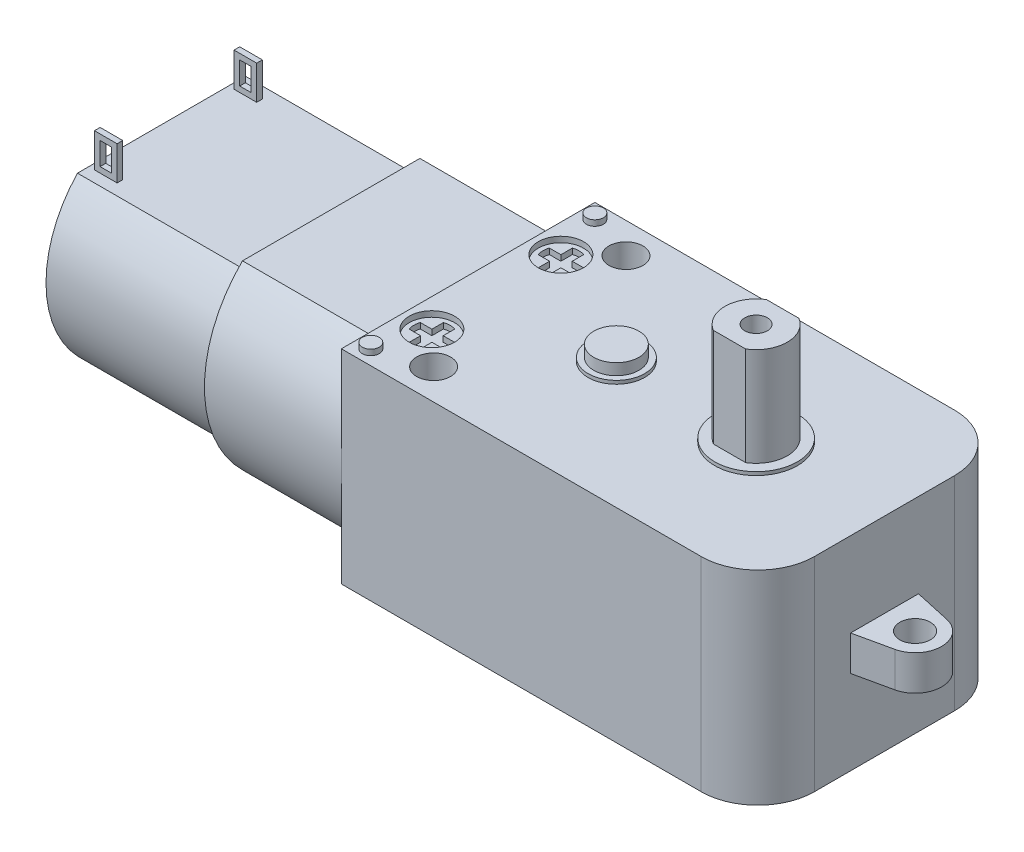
SolidWorks part; units mm, degrees
ref_plane "Front Plane" through (0, 0, 0) normal (0, 0, 1) x (1, 0, 0)
ref_plane "Top Plane" through (0, 0, 0) normal (0, 1, 0) x (1, 0, 0)
ref_plane "Right Plane" through (0, 0, 0) normal (1, 0, 0) x (0, 0, -1)
sketch "Sketch1" plane through (0, 0, 0) normal (0, 1, 0) x (1, 0, 0)
  line L1 (0, 0) -> (36.8, 0)
  line L2 (0, 0) -> (0, 22.4)
  line L3 (0, 22.4) -> (36.8, 22.4)
  line L4 (36.8, 0) -> (36.8, 22.4)
  dimension "D1" = 36.8
  dimension "D2" = 22.4
extrude "Extrude1" add sketch "Sketch1" along normal mid plane 18
fillet "Fillet1" radius 5 2 edges at (36.8, 0, -22.4) (36.8, 0, 0)
sketch "Sketch2" plane through (0, 0, 0) normal (0, 1, 0) x (1, 0, 0)
  line L0 (36.8, 11.2) -> (43.7927, 11.2) construction
  line L1 (36.8, 5) -> (36.8, 17.4) construction
  line L2 (36.8, 14.2) -> (40.0048, 13.4951)
  line L3 (36.8, 8.2) -> (40.0048, 8.9049)
  line L4 (36.8, 14.2) -> (36.8, 8.2)
  circle A0 centre (39.5, 11.2) radius 1.35
  arc A1 (40.0048, 8.9049) -> (40.0048, 13.4951) centre (39.5, 11.2) ccw
  dimension "D1" = 2.7
  dimension "D3" = 1
  dimension "D2" = 3
  dimension "D4" = 2.7
extrude "Extrude2" add sketch "Sketch2" along normal mid plane 3.1
sketch "Sketch3" plane through (0, 9, 0) normal (0, 1, 0) x (1, 0, 0)
  line L0 (36.8, 11.2) -> (0, 11.2) construction
  line L1 (36.8, 5) -> (36.8, 17.4) construction
  line L2 (0, 22.4) -> (0, 0) construction
  circle A0 centre (25.45, 11.2) radius 3.65
  circle A1 centre (13.1, 11.2) radius 2.5
  dimension "D1" = 7.3
  dimension "D2" = 11.35
  dimension "D3" = 5
  dimension "D4" = 12.35
extrude "Extrude3" add sketch "Sketch3" along normal blind 0.3
sketch "Sketch4" plane through (0, 9.3, 0) normal (0, 1, 0) x (1, 0, 0)
  line L0 (22.7, 11.2) -> (28.2, 11.2) construction
  line L1 (24.0217, 8.85) -> (26.8783, 8.85)
  line L2 (24.0217, 13.55) -> (26.8783, 13.55)
  line L3 (22.7, 13.55) -> (28.2, 13.55) construction
  line L4 (22.7, 8.85) -> (28.2, 8.85) construction
  arc A0 (24.0217, 13.55) -> (24.0217, 8.85) centre (25.45, 11.2) ccw
  circle A1 centre (25.45, 11.2) radius 1
  arc A2 (26.8783, 8.85) -> (26.8783, 13.55) centre (25.45, 11.2) ccw
  dimension "D1" = 5.5
  dimension "D2" = 2
  dimension "D3" = 2.35
  dimension "D4" = 2.35
extrude "Extrude4" add sketch "Sketch4" along normal blind 8.7
sketch "Sketch6" plane through (0, 9.3, 0) normal (0, 1, 0) x (1, 0, 0)
  circle A0 centre (13.1, 11.2) radius 2
  dimension "D1" = 4
extrude "Extrude5" add sketch "Sketch6" along normal blind 1
sketch "Sketch7" plane through (0, 9, 0) normal (0, 1, 0) x (1, 0, 0)
  line L0 (5.45, 22.4) -> (5.45, 0) construction
  line L1 (31.8, 22.4) -> (0, 22.4) construction
  line L2 (0, 0) -> (31.8, 0) construction
  line L4 (0, 11.2) -> (8.5993, 11.2) construction
  line L5 (0, 22.4) -> (0, 0) construction
  circle A0 centre (5.45, 19.7) radius 1.5
  circle A1 centre (5.45, 2.7) radius 1.5
  circle A2 centre (25.45, 11.2) radius 3.65 construction
  dimension "D1" = 3
  dimension "D2" = 8.5
  dimension "D3" = 8.5
  dimension "D4" = 20
extrude "Extrude6" cut sketch "Sketch7" against normal through all
sketch "Sketch8" plane through (0, 9, 0) normal (0, 1, 0) x (1, 0, 0)
  line L0 (2.5, 22.4) -> (2.5, 0) construction
  line L1 (31.8, 22.4) -> (0, 22.4) construction
  line L2 (0, 0) -> (31.8, 0) construction
  line L3 (0, 22.4) -> (0, 0) construction
  circle A0 centre (2.5, 16.9) radius 2
  circle A1 centre (2.5, 5.5) radius 2
  dimension "D1" = 4
  dimension "D2" = 5.5
  dimension "D3" = 5.5
  dimension "D4" = 2.5
extrude "Extrude7" cut sketch "Sketch8" against normal blind 0.5
sketch "Sketch9" plane through (0, 8.5, 0) normal (0, 1, 0) x (1, 0, 0)
  line L0 (2.5, 18.5) -> (2.5, 15.3) construction
  line L1 (4.1, 16.9) -> (0.9, 16.9) construction
  line L2 (0.9, 5.5) -> (4.1, 5.5) construction
  line L3 (2.5, 7.1) -> (2.5, 3.9) construction
  line L4 (2, 7.0199) -> (2, 6)
  line L5 (3, 7.0199) -> (3, 6)
  line L6 (4.0199, 17.4) -> (3, 17.4)
  line L7 (2, 18.4199) -> (2, 17.4)
  line L8 (0.9801, 5) -> (2, 5)
  line L9 (4.0199, 16.4) -> (3, 16.4)
  line L10 (3, 18.4199) -> (3, 17.4)
  line L11 (0.9801, 6) -> (2, 6)
  line L12 (2, 18.5) -> (2, 15.3) construction
  line L13 (3, 18.5) -> (3, 15.3) construction
  line L14 (4.1, 17.4) -> (0.9, 17.4) construction
  line L15 (4.1, 16.4) -> (0.9, 16.4) construction
  line L16 (2, 7.1) -> (2, 3.9) construction
  line L17 (3, 7.1) -> (3, 3.9) construction
  line L18 (0.9, 6) -> (4.1, 6) construction
  line L19 (0.9, 5) -> (4.1, 5) construction
  line L20 (2, 17.4) -> (0.9801, 17.4)
  line L21 (2, 16.4) -> (2, 15.3801)
  line L22 (3, 16.4) -> (3, 15.3801)
  line L23 (2, 16.4) -> (0.9801, 16.4)
  line L24 (3, 6) -> (4.0199, 6)
  line L25 (2, 5) -> (2, 3.9801)
  line L26 (3, 5) -> (3, 3.9801)
  line L27 (3, 5) -> (4.0199, 5)
  arc A0 (3, 7.0199) -> (2, 7.0199) centre (2.5, 5.5) ccw
  arc A1 (3, 18.4199) -> (2, 18.4199) centre (2.5, 16.9) ccw
  arc A2 (4.0199, 16.4) -> (4.0199, 17.4) centre (2.5, 16.9) ccw
  arc A3 (2, 15.3801) -> (3, 15.3801) centre (2.5, 16.9) ccw
  arc A4 (0.9801, 17.4) -> (0.9801, 16.4) centre (2.5, 16.9) ccw
  arc A5 (4.0199, 5) -> (4.0199, 6) centre (2.5, 5.5) ccw
  arc A6 (2, 3.9801) -> (3, 3.9801) centre (2.5, 5.5) ccw
  arc A7 (0.9801, 6) -> (0.9801, 5) centre (2.5, 5.5) ccw
  dimension "D1" = 3.2
  dimension "D6" = 1.6
  dimension "D2" = 0.5
  dimension "D3" = 0.5
  dimension "D4" = 0.5
  dimension "D5" = 0.5
extrude "Extrude8" cut sketch "Sketch9" against normal blind 0.5
sketch "Sketch10" plane through (0, 9, 0) normal (0, 1, 0) x (1, 0, 0)
  line L0 (1.3, 22.4) -> (1.3, 0) construction
  line L1 (31.8, 22.4) -> (0, 22.4) construction
  line L2 (0, 0) -> (31.8, 0) construction
  line L3 (0, 22.4) -> (0, 0) construction
  circle A0 centre (1.3, 21.1) radius 0.75
  circle A1 centre (1.3, 1.3) radius 0.75
  dimension "D1" = 1.5
  dimension "D3" = 1.3
  dimension "D4" = 1.3
  dimension "D2" = 1.3
extrude "Extrude9" add sketch "Sketch10" along normal blind 0.5
sketch "Sketch12" plane through (0, 0, 0) normal (-1, 0, 0) x (0, 0, 1)
  line L0 (-22.4, 9) -> (0, -9) construction
  line L1 (-19.0384, 8) -> (-3.3616, 8)
  line L4 (-3.3616, -8) -> (-19.0384, -8)
  line L5 (-11.2, 0) -> (-22.4, 0) construction
  arc A0 (-19.0384, 8) -> (-19.0384, -8) centre (-11.2, 0) ccw
  arc A1 (-3.3616, -8) -> (-3.3616, 8) centre (-11.2, 0) ccw
  dimension "D1" = 16
  dimension "D2" = 8
extrude "Extrude11" add sketch "Sketch12" along normal blind 12.1
sketch "Sketch13" plane through (-12.1, 0, 0) normal (-1, 0, 0) x (0, 0, 1)
  line L14 (-18.6189, -7) -> (-3.7811, -7)
  line L15 (-3.7811, 7) -> (-18.6189, 7)
  line L16 (-18.6189, -7) -> (-3.7811, -7)
  line L17 (-3.7811, 7) -> (-18.6189, 7)
  arc A14 (-18.6189, 7) -> (-18.6189, -7) centre (-11.2, 0) ccw
  arc A15 (-3.7811, -7) -> (-3.7811, 7) centre (-11.2, 0) ccw
  arc A16 (-18.6189, 7) -> (-18.6189, -7) centre (-11.2, 0) ccw
  arc A17 (-3.7811, -7) -> (-3.7811, 7) centre (-11.2, 0) ccw
  dimension "D3" = 1
extrude "Extrude12" add sketch "Sketch13" along normal blind 15
sketch "Sketch14" plane through (-27.1, 0, 0) normal (-1, 0, 0) x (0, 0, 1)
  line L0 (-18.6189, -7) -> (-3.7811, 7) construction
  circle A0 centre (-11.2, 0) radius 4
  dimension "D1" = 8
extrude "Extrude13" add sketch "Sketch14" along normal blind 1
sketch "Sketch15" plane through (-28.1, 0, 0) normal (-1, 0, 0) x (0, 0, 1)
  circle A0 centre (-11.2, 0) radius 1
  dimension "D1" = 2
extrude "Extrude14" add sketch "Sketch15" along normal blind 1
sketch "Sketch16" plane through (0, 7, 0) normal (0, 1, 0) x (1, 0, 0)
  line L0 (-27.1, 18.6189) -> (-12.1, 18.6189) construction
  line L1 (-26.6, 17.6189) -> (-24.6, 17.6189)
  line L2 (-26.6, 17.6189) -> (-26.6, 17.1189)
  line L3 (-26.6, 17.1189) -> (-24.6, 17.1189)
  line L4 (-24.6, 17.6189) -> (-24.6, 17.1189)
  line L5 (-26.6, 5.2811) -> (-24.6, 5.2811)
  line L6 (-26.6, 5.2811) -> (-26.6, 4.7811)
  line L7 (-26.6, 4.7811) -> (-24.6, 4.7811)
  line L8 (-24.6, 5.2811) -> (-24.6, 4.7811)
  line L9 (-27.1, 3.7811) -> (-12.1, 3.7811) construction
  line L10 (-27.1, 3.7811) -> (-27.1, 18.6189) construction
  dimension "D1" = 2
  dimension "D2" = 0.5
  dimension "D3" = 0.5
  dimension "D4" = 2
  dimension "D5" = 1
  dimension "D6" = 1
  dimension "D7" = 0.5
  dimension "D8" = 0.5
extrude "Extrude15" add sketch "Sketch16" along normal blind 3
sketch "Sketch17" plane through (0, 0, -4.7811) normal (0, 0, 1) x (1, 0, 0)
  line L0 (-26.6, 10) -> (-24.6, 10) construction
  line L1 (-26.1, 9.5) -> (-25.1, 9.5)
  line L2 (-26.1, 9.5) -> (-26.1, 7.5)
  line L3 (-26.1, 7.5) -> (-25.1, 7.5)
  line L4 (-25.1, 9.5) -> (-25.1, 7.5)
  line L5 (-26.6, 7) -> (-24.6, 7) construction
  line L6 (-26.6, 10) -> (-26.6, 7) construction
  line L7 (-24.6, 10) -> (-24.6, 7) construction
  dimension "D1" = 0.5
  dimension "D2" = 0.5
  dimension "D3" = 0.5
  dimension "D4" = 0.5
extrude "Extrude16" cut sketch "Sketch17" against normal through all
